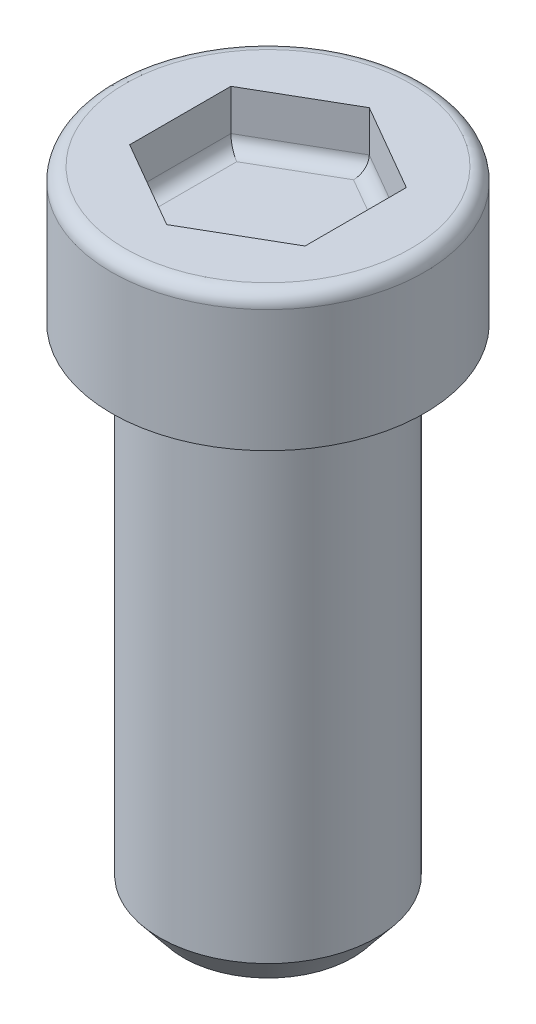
SolidWorks part; units mm, degrees
ref_plane "Plan de face" through (0, 0, 0) normal (0, 0, 1) x (1, 0, 0)
ref_plane "Plan de dessus" through (0, 0, 0) normal (0, 1, 0) x (1, 0, 0)
ref_plane "Plan de droite" through (0, 0, 0) normal (1, 0, 0) x (0, 0, -1)
sketch "Esquisse1" plane through (-222.9287, 0, 0) normal (1, 0, 0) x (0, 0, -1)
  line L0 (-50, -25.1108) -> (-50, -49.0899) construction
  line L1 (-46, -25.1108) -> (-54, -25.1108) construction
  line L2 (-50, -45.1108) -> (-50, -55.1108) construction
  line L3 (-43, -25.1108) -> (-297, -25.1108) construction
  line L4 (-50, -43.7107) -> (-46.9046, -43.7107)
  line L5 (-50, -43.7107) -> (-50, -25.1108)
  line L6 (-46.9046, -43.7107) -> (-46.0255, -42.6314)
  line L7 (-46.0255, -42.6314) -> (-46.0255, -25.1108)
  line L9 (-46.0255, -25.1108) -> (-44.2661, -25.1108)
  line L10 (-50, -25.1108) -> (-50, -20.1336)
  line L11 (-50, -20.1336) -> (-44.7661, -20.1336)
  line L12 (-44.2661, -25.1108) -> (-44.2661, -20.6336)
  arc A0 (-44.2661, -20.6336) -> (-44.7661, -20.1336) centre (-44.7661, -20.6336) ccw
  dimension "D1" = 0.5
  dimension "D2" = 3.9745
  dimension "D3" = 18.5998
revolve "Révolution1" add sketch "Esquisse1" angle 360 about L0
sketch "Esquisse2" plane through (0, -20.1336, 0) normal (0, 1, 0) x (1, 0, 0)
  line L1 (-222.9287, -46.2891) -> (-226.1425, -48.1445)
  line L2 (-226.1425, -48.1445) -> (-226.1425, -51.8555)
  line L3 (-226.1425, -51.8555) -> (-222.9287, -53.7109)
  line L4 (-222.9287, -53.7109) -> (-219.7149, -51.8555)
  line L5 (-219.7149, -51.8555) -> (-219.7149, -48.1445)
  line L6 (-219.7149, -48.1445) -> (-222.9287, -46.2891)
  circle A0 centre (-222.9287, -50) radius 3.2138 construction
extrude "Enlèv. mat.-Extru.1" cut sketch "Esquisse2" against normal blind 2
fillet "Congé1" radius 0.5 6 edges at (-219.7149, -22.1336, 50) (-221.3218, -22.1336, 52.7832) (-224.5356, -22.1336, 52.7832) (-226.1425, -22.1336, 50) (-224.5356, -22.1336, 47.2168) (-221.3218, -22.1336, 47.2168)
